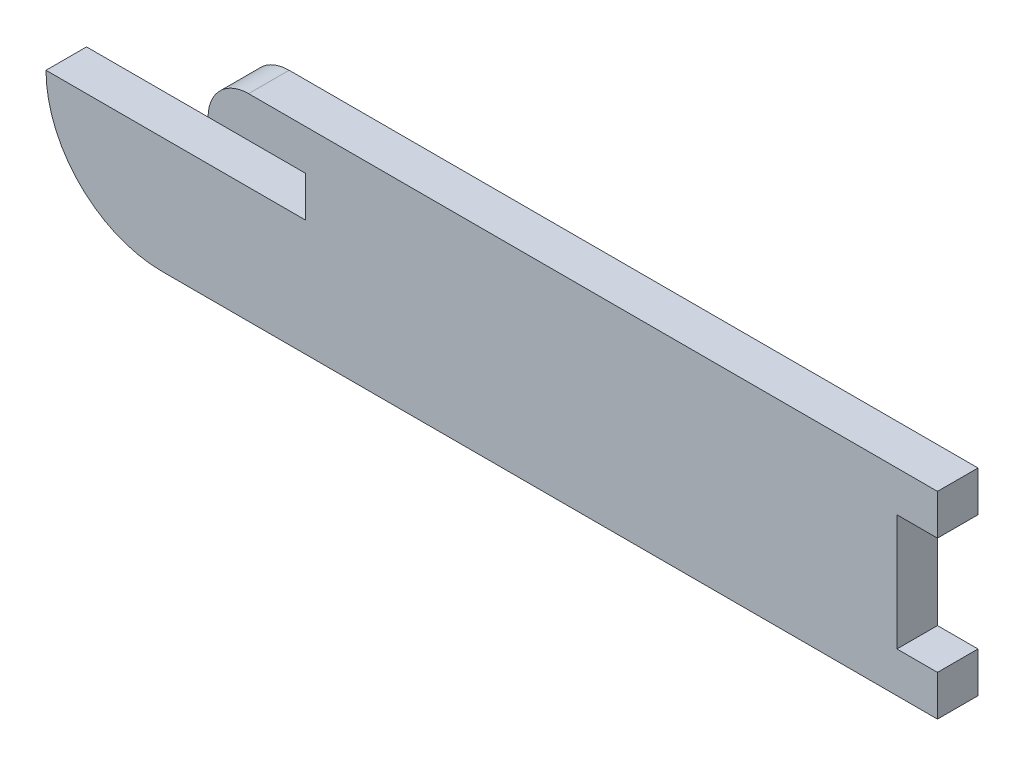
SolidWorks part; units mm, degrees
ref_plane "Front Plane" through (0, 0, 0) normal (0, 0, 1) x (1, 0, 0)
ref_plane "Top Plane" through (0, 0, 0) normal (0, 1, 0) x (1, 0, 0)
ref_plane "Right Plane" through (0, 0, 0) normal (1, 0, 0) x (0, 0, -1)
sketch "Sketch1" plane through (0, 0, 0) normal (0, 0, 1) x (1, 0, 0)
  line L1 (-28.575, 7.7279) -> (28.575, 7.7279)
  line L2 (-28.575, 7.7279) -> (-28.575, -7.728)
  line L3 (-28.575, -7.728) -> (28.575, -7.728)
  line L4 (28.575, 7.7279) -> (28.575, -7.728)
  line L5 (-28.575, 7.7279) -> (28.575, -7.728) construction
  line L6 (-28.575, -7.728) -> (28.575, 7.7279) construction
  point P0 (0, 0)
  dimension "D1" = 15.4559
  dimension "D2" = 57.15
extrude "Boss-Extrude1" add sketch "Sketch1" along normal mid plane 3.175
sketch "Sketch8" plane through (0, 0, 1.5875) normal (0, 0, 1) x (1, 0, 0)
  line L0 (28.575, -7.728) -> (28.575, 7.7279) construction
  line L1 (28.575, 4.553) -> (25.4, 4.5529)
  line L2 (28.575, 4.553) -> (28.575, -4.5529)
  line L3 (28.575, -4.5529) -> (25.4, -4.5529)
  line L4 (25.4, 4.5529) -> (25.4, -4.5529)
  line L5 (28.575, 7.7279) -> (-28.575, 7.7279) construction
  line L6 (-28.575, -7.728) -> (28.575, -7.728) construction
  dimension "D1" = 3.175
  dimension "D2" = 3.175
  dimension "D3" = 3.175
extrude "Cut-Extrude4" cut sketch "Sketch8" against normal through all
sketch "Sketch9" plane through (0, 0, 1.5875) normal (0, 0, 1) x (1, 0, 0)
  line L0 (-28.575, 7.7279) -> (-28.575, -7.728) construction
  line L1 (-28.575, 4.5529) -> (-20.955, 4.5529)
  line L2 (-28.575, 4.5529) -> (-28.575, 1.3779)
  line L3 (-28.575, 1.3779) -> (-20.955, 1.3779)
  line L4 (-20.955, 4.5529) -> (-20.955, 1.3779)
  line L5 (28.575, 7.7279) -> (-28.575, 7.7279) construction
  dimension "D1" = 3.175
  dimension "D2" = 3.175
  dimension "D3" = 7.62
extrude "Cut-Extrude5" cut sketch "Sketch9" against normal through all
sketch "Sketch10" plane through (0, 0, 1.5875) normal (0, 0, 1) x (1, 0, 0)
  line L0 (-28.575, -7.728) -> (28.575, -7.728) construction
  line L1 (-28.575, 1.3779) -> (-41.275, 1.3779)
  line L2 (-28.575, 1.3779) -> (-28.575, -7.728)
  line L3 (-28.575, -7.728) -> (-41.275, -7.728)
  line L4 (-41.275, 1.3779) -> (-41.275, -7.728)
  dimension "D1" = 12.7
extrude "Boss-Extrude2" add sketch "Sketch10" against normal through all
sketch "Sketch12" plane through (0, 0, 1.5875) normal (0, 0, 1) x (1, 0, 0)
  line L3 (-41.275, 1.3779) -> (-41.275, -7.728)
  line L4 (-41.275, -7.728) -> (-32.1691, -7.728)
  line L5 (-41.275, -7.728) -> (28.575, -7.728) construction
  arc A0 (-41.275, 1.3779) -> (-32.1691, -7.728) centre (-32.1691, 1.3779) ccw
extrude "Cut-Extrude6" cut sketch "Sketch12" against normal through all
fillet "Fillet1" radius 3.175 1 edges at (-28.575, 7.7279, 0)
